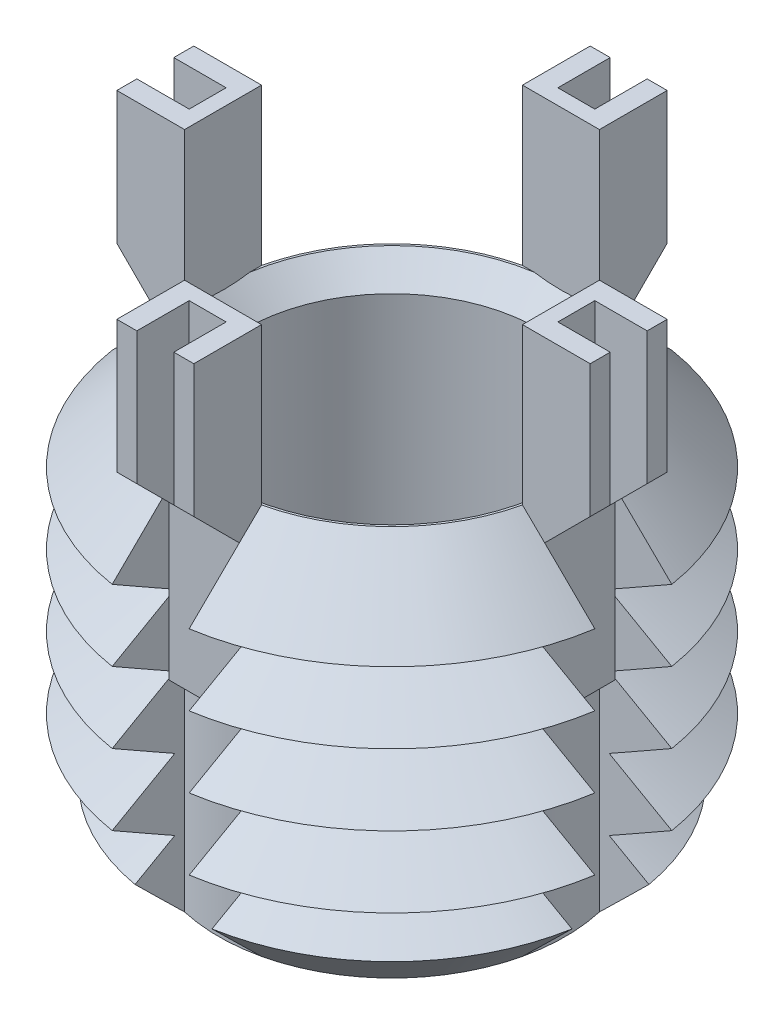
SolidWorks part; units mm, degrees
ref_plane "Front Plane" through (0, 0, 0) normal (0, 0, 1) x (1, 0, 0)
ref_plane "Top Plane" through (0, 0, 0) normal (0, 1, 0) x (1, 0, 0)
ref_plane "Right Plane" through (0, 0, 0) normal (1, 0, 0) x (0, 0, -1)
sketch "Sketch1" plane through (0, 0, 0) normal (0, 1, 0) x (1, 0, 0)
  circle A0 centre (0, 0) radius 7.9375
  dimension "D1" = 15.875
extrude "Boss-Extrude1" add sketch "Sketch1" against normal blind 12.7
chamfer "Chamfer1" distance 2.309 angle 45 2 edges at (0, -12.7, 7.9375) (0, 0, 7.9375)
sketch "Sketch2" plane through (0, 0, 0) normal (1, 0, 0) x (0, 0, -1)
  line L0 (0, 0.8859) -> (0, -9.2617) construction
sketch "Sketch3" plane through (0, 0, 0) normal (1, 0, 0) x (0, 0, -1)
  line L0 (-7.9375, -2.309) -> (-5.9378, -3.4635)
  line L1 (-5.9378, -3.4635) -> (-7.9375, -4.618)
  line L2 (-7.9375, -2.309) -> (-7.9375, -10.391) construction
  line L3 (-7.9375, -4.618) -> (-7.9375, -2.309)
  dimension "D1" = 2.309
revolve "Cut-Revolve1" cut sketch "Sketch3" angle 360 about L0
pattern_linear "LPattern1" count 4 spacing 2.309 along (0, -1, 0) of "Cut-Revolve1"
sketch "Sketch4" plane through (0, 0, 0) normal (0, 1, 0) x (1, 0, 0)
  line L0 (-5.4879, 1.25) -> (-7.8385, 1.25)
  line L2 (-7.8385, -1.25) -> (-5.4879, -1.25)
  arc A0 (-5.4879, 1.25) -> (-5.4879, -1.25) centre (0, 0) ccw
  arc A1 (-7.8385, 1.25) -> (-7.8385, -1.25) centre (0, 0) ccw
  circle A2 centre (0, 0) radius 7.9375 construction
  circle A3 centre (0, 0) radius 5.6285 construction
  point P1 (-5.6285, 0)
  point P3 (-7.9375, 0)
  point P13 (0, 0)
  dimension "D1" = 2.5
extrude "Cut-Extrude1" cut sketch "Sketch4" against normal up to surface (12.7 mm away)
pattern_circular "CirPattern1" count 4 over 360 about axis through (0, 0, 0) along (0, 1, 0) of "Cut-Extrude1"
sketch "Sketch5" plane through (0, 0, 0) normal (1, 0, 0) x (0, 0, -1)
  line L0 (-5.4879, 5.073) -> (-5.4879, -5.927)
  line L1 (-5.4879, -5.927) -> (-5.9879, -5.927)
  line L2 (-5.9879, -5.927) -> (-5.9879, -0.927)
  line L3 (-5.9879, -0.927) -> (-7.6879, 0.773)
  line L4 (-7.6879, 0.773) -> (-7.6879, 5.073)
  line L5 (-7.6879, 5.073) -> (-5.4879, 5.073)
  line L6 (-7.8385, -6.927) -> (-1.25, -6.927) construction
  point P9 (-1.25, 0)
  point P10 (-5.9879, -0.927)
  dimension "D1" = 1
  dimension "D2" = 11
  dimension "D3" = 6
  dimension "D4" = 2.2
  dimension "D5" = 0.5
  dimension "D6" = 45
extrude "Boss-Extrude3" add sketch "Sketch5" along normal mid plane 2.5
pattern_circular "CirPattern2" count 4 over 360 about axis through (0, 0, 0) along (0, 1, 0) of "Boss-Extrude3"
sketch "Sketch6" plane through (0, 5.073, 0) normal (0, 1, 0) x (1, 0, 0)
  line L0 (-7.6879, -1.25) -> (-7.6879, 1.25) construction
  line L1 (-7.6879, -0.6) -> (-5.9879, -0.6)
  line L2 (-7.6879, -0.6) -> (-7.6879, 0.6)
  line L3 (-7.6879, 0.6) -> (-5.9879, 0.6)
  line L4 (-5.9879, -0.6) -> (-5.9879, 0.6)
  line L5 (-7.6879, -0.6) -> (-5.9879, 0.6) construction
  line L6 (-7.6879, 0.6) -> (-5.9879, -0.6) construction
  line L7 (7.6879, 1.25) -> (7.6879, -1.25) construction
  line L8 (-0.6, 5.9879) -> (0.6, 5.9879)
  line L9 (-0.6, 5.9879) -> (-0.6, 7.6879)
  line L10 (-0.6, 7.6879) -> (0.6, 7.6879)
  line L11 (0.6, 5.9879) -> (0.6, 7.6879)
  line L12 (-0.6, 5.9879) -> (0.6, 7.6879) construction
  line L13 (-0.6, 7.6879) -> (0.6, 5.9879) construction
  line L14 (5.9879, -0.6) -> (7.6879, -0.6)
  line L15 (5.9879, -0.6) -> (5.9879, 0.6)
  line L16 (5.9879, 0.6) -> (7.6879, 0.6)
  line L17 (7.6879, -0.6) -> (7.6879, 0.6)
  line L18 (5.9879, -0.6) -> (7.6879, 0.6) construction
  line L19 (5.9879, 0.6) -> (7.6879, -0.6) construction
  line L20 (-0.6, -7.6879) -> (0.6, -7.6879)
  line L21 (-0.6, -7.6879) -> (-0.6, -5.9879)
  line L22 (-0.6, -5.9879) -> (0.6, -5.9879)
  line L23 (0.6, -7.6879) -> (0.6, -5.9879)
  line L24 (-0.6, -7.6879) -> (0.6, -5.9879) construction
  line L25 (-0.6, -5.9879) -> (0.6, -7.6879) construction
  line L26 (-1.25, 7.6879) -> (1.25, 7.6879) construction
  line L27 (1.25, -7.6879) -> (-1.25, -7.6879) construction
  point P0 (-6.8379, 0)
  point P7 (-7.6879, 0)
  point P8 (-7.6879, 0)
  point P9 (0, 6.8379)
  point P14 (6.8379, 0)
  point P19 (0, -6.8379)
  point P24 (0, 7.6879)
  point P25 (7.6879, 0)
  point P26 (7.6879, 0)
  point P27 (0, 7.6879)
  point P30 (0, -7.6879)
  point P33 (0, -7.6879)
  dimension "D1" = 1.2
  dimension "D2" = 1.7
extrude "Cut-Extrude3" cut sketch "Sketch6" against normal through all both and the other way through all
sketch "Sketch7" plane through (0, 0, 0) normal (0, 1, 0) x (1, 0, 0)
  circle A0 centre (0, 0) radius 4.7625
  dimension "D1" = 9.525
extrude "Cut-Extrude4" cut sketch "Sketch7" against normal up to surface (12.7 mm away)
chamfer "Chamfer2" distance 0.7935 angle 45 2 edges at (0, 0, 4.7625) (0, -12.7, 4.7625)
